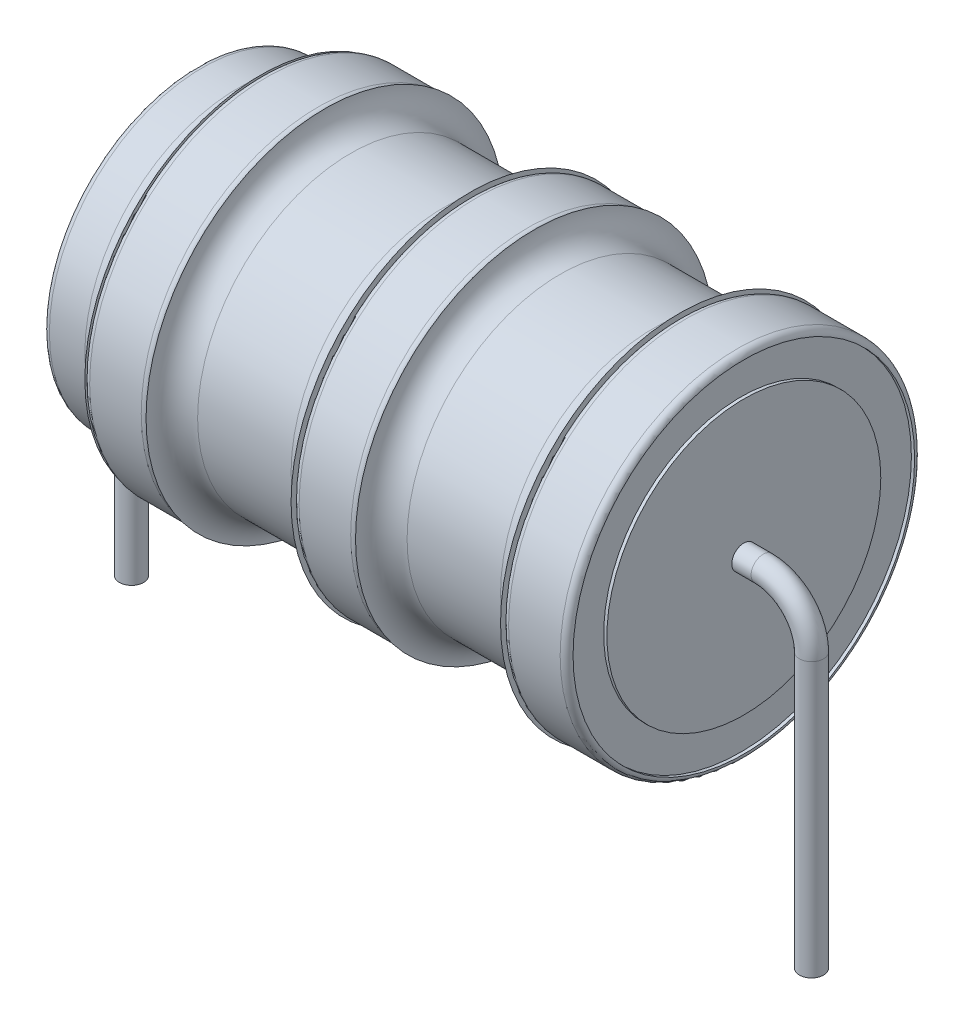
SolidWorks part; units mm, degrees
ref_plane "Plan de face" through (0, 0, 0) normal (0, 0, 1) x (1, 0, 0)
ref_plane "Plan de dessus" through (0, 0, 0) normal (0, 1, 0) x (1, 0, 0)
ref_plane "Plan de droite" through (0, 0, 0) normal (1, 0, 0) x (0, 0, -1)
sketch "Esquisse1" plane through (0, 0, 0) normal (0, 0, 1) x (1, 0, 0)
  line L0 (0, 0) -> (66.5102, 0) construction
  line L1 (0, 0) -> (0, 4.55)
  line L2 (0.2, 4.75) -> (1.3, 4.75)
  line L3 (2, 5.45) -> (2, 5.3)
  line L4 (2.2, 5.5) -> (3.8, 5.5)
  line L5 (4, 5.3) -> (4, 5.55)
  line L6 (4.8, 4.75) -> (7.7, 4.75)
  line L7 (8.5, 5.55) -> (8.5, 5.3)
  line L8 (8.7, 5.5) -> (10.3, 5.5)
  line L9 (10.5, 5.3) -> (10.5, 5.55)
  line L10 (11.3, 4.75) -> (14.2, 4.75)
  line L11 (15, 5.55) -> (15, 5.3)
  line L12 (15.2, 5.5) -> (16.8, 5.5)
  line L13 (17, 5.3) -> (17, 0)
  line L14 (0, 0) -> (17, 0)
  arc A0 (2, 5.45) -> (1.3, 4.75) centre (1.3, 5.45) cw
  arc A1 (4.8, 4.75) -> (4, 5.55) centre (4.8, 5.55) cw
  arc A2 (7.7, 4.75) -> (8.5, 5.55) centre (7.7, 5.55) ccw
  arc A3 (11.3, 4.75) -> (10.5, 5.55) centre (11.3, 5.55) cw
  arc A4 (14.2, 4.75) -> (15, 5.55) centre (14.2, 5.55) ccw
  arc A5 (2.2, 5.5) -> (2, 5.3) centre (2.2, 5.3) ccw
  arc A6 (4, 5.3) -> (3.8, 5.5) centre (3.8, 5.3) ccw
  arc A7 (8.7, 5.5) -> (8.5, 5.3) centre (8.7, 5.3) ccw
  arc A8 (10.3, 5.5) -> (10.5, 5.3) centre (10.3, 5.3) cw
  arc A9 (15.2, 5.5) -> (15, 5.3) centre (15.2, 5.3) ccw
  arc A10 (17, 5.3) -> (16.8, 5.5) centre (16.8, 5.3) ccw
  arc A11 (0.2, 4.75) -> (0, 4.55) centre (0.2, 4.55) ccw
  point P24 (10.5, 4.75)
  point P27 (15, 4.75)
  point P34 (8.5, 5.5)
  point P37 (10.5, 5.5)
  point P40 (15, 5.5)
  point P43 (17, 5.5)
  point P46 (0, 4.75)
  dimension "D9" = 0.7
  dimension "D10" = 0.8
  dimension "D11" = 0.2
  dimension "D1" = 4.75
  dimension "D2" = 5.5
  dimension "D3" = 2
  dimension "D4" = 2
  dimension "D5" = 4.5
  dimension "D6" = 2
  dimension "D7" = 4.5
  dimension "D8" = 2
revolve "Révolution1" add sketch "Esquisse1" angle 360 about L0
sketch "Esquisse2" plane through (0, 0, 0) normal (-1, 0, 0) x (0, 0, 1)
  circle A0 centre (0, 0) radius 4.25
extrude "Enlèv. mat.-Extru.1" cut sketch "Esquisse2" against normal blind 0.1
sketch "Esquisse3" plane through (17, 0, 0) normal (1, 0, 0) x (0, 0, -1)
  circle A0 centre (0, 0) radius 4.25
  circle A1 centre (0, 0) radius 5.3
  circle A2 centre (0, 0) radius 5.3
  dimension "D2" = 8.5
  dimension "D1" = 0
extrude "Enlèv. mat.-Extru.2" cut sketch "Esquisse3" against normal blind 0.1
sketch "Esquisse4" plane through (0.1, 0, 0) normal (-1, 0, 0) x (0, 0, 1)
  circle A0 centre (0, 0) radius 0.375
  dimension "D1" = 0.75
sketch "Esquisse5" plane through (0, 0, 0) normal (0, 0, 1) x (1, 0, 0)
  line L0 (0, 0) -> (-0.5, 0)
  line L1 (-2, -1.5) -> (-2, -10)
  line L2 (0, 0) -> (0.1, 0)
  line L3 (0.1, 0.375) -> (0.1, -0.375) construction
  arc A0 (-2, -1.5) -> (-0.5, 0) centre (-0.5, -1.5) cw
  point P6 (-2, 0)
  dimension "D3" = 1.5
  dimension "D1" = 2
  dimension "D2" = 10
sweep "Balayage4" add profiles "Esquisse4" path "Esquisse5"
ref_plane "Plan1" through (8.55, 0, 0) normal (-1, 0, 0) x (0, 0, 1)
mirror "Symétrie1" about plane through (8.55, 0, 0) normal (-1, 0, 0) of "Balayage4"
